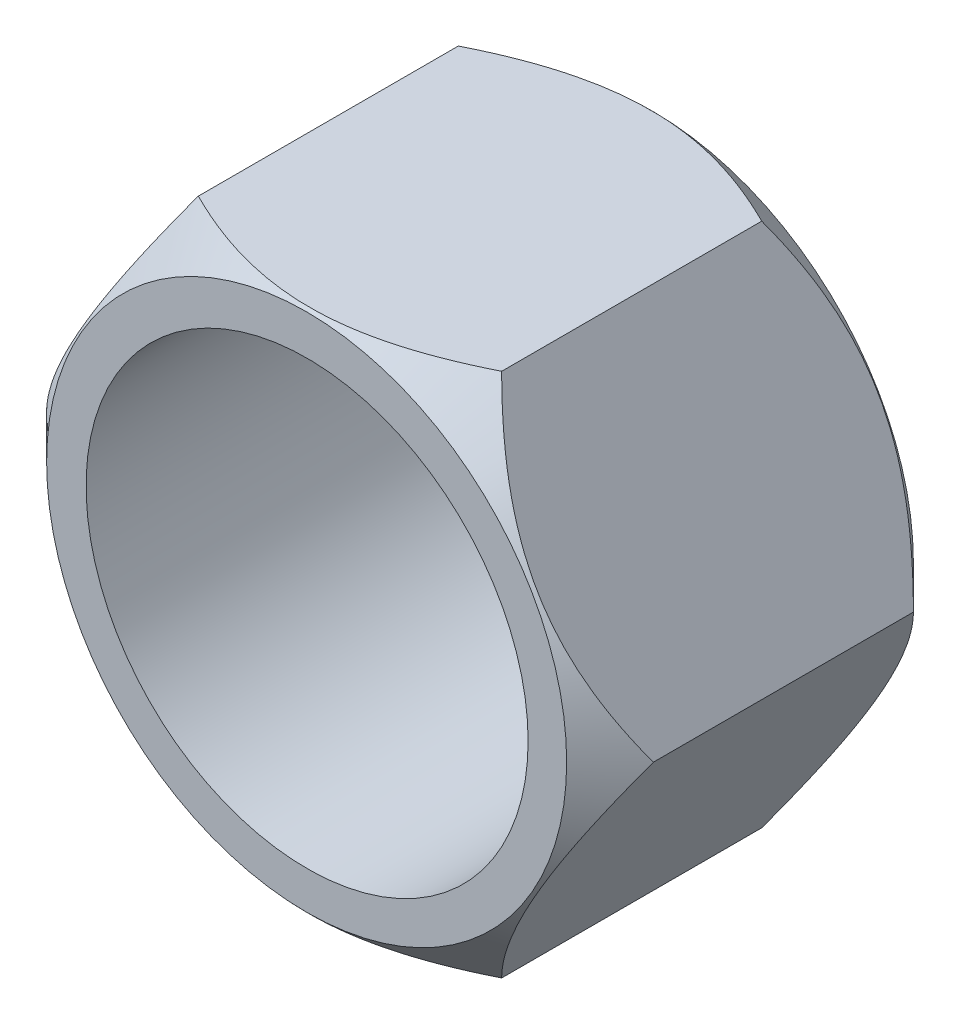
SolidWorks part; units mm, degrees
ref_plane "Face" through (0, 0, 0) normal (0, 0, 1) x (1, 0, 0)
ref_plane "Dessus" through (0, 0, 0) normal (0, 1, 0) x (1, 0, 0)
ref_plane "Droite" through (0, 0, 0) normal (1, 0, 0) x (0, 0, -1)
sketch "Esquisse1" plane through (0, 0, 0) normal (0, 0, 1) x (1, 0, 0)
  circle A0 centre (0, 0) radius 9
  dimension "D1" = 18
extrude "Extrusion1" add sketch "Esquisse1" along normal blind 8
hole_wizard "Trou taraudé M121" positions "Esquisse3" profile "Esquisse2" tap size "M12" standard "ISO"
sketch "Esquisse3" plane through (0, 0, 8) normal (0, 0, 1) x (1, 0, 0)
  point P0 (0.0105, -0.0209)
sketch "Esquisse2" plane through (0.0105, -0.0209, 8) normal (1, 0, 0) x (0, -1, 0)
  line L0 (0, 0) -> (0, 8)
  line L1 (0, 8) -> (5.1, 8)
  line L2 (5.1, 8) -> (5.1, 0)
  line L5 (5.1, 0) -> (0, 0)
  line L11 (0, -6.35) -> (0, 107.95) construction
  dimension "Diamètre du trou pour taraudage jusqu'au prochain" = 10.2
  dimension "Profondeur du trou pour taraudage jusqu'au prochain" = 8
chamfer "Chanfrein1" distance 3 angle 45 2 edges at (9, 0, 0) (9, 0, 8)
sketch "Esquisse4" plane through (0, 0, 8) normal (0, 0, 1) x (1, 0, 0)
  line L1 (7, 0) -> (3.5, 6.0622)
  line L2 (3.5, 6.0622) -> (-3.5, 6.0622)
  line L3 (-3.5, 6.0622) -> (-7, 0)
  line L4 (-7, 0) -> (-3.5, -6.0622)
  line L5 (-3.5, -6.0622) -> (3.5, -6.0622)
  line L6 (3.5, -6.0622) -> (7, 0)
  circle A0 centre (0, 0) radius 6.0622 construction
extrude "Enlèv. mat.-Extru.1" cut sketch "Esquisse4" against normal blind 10 flip side to cut
